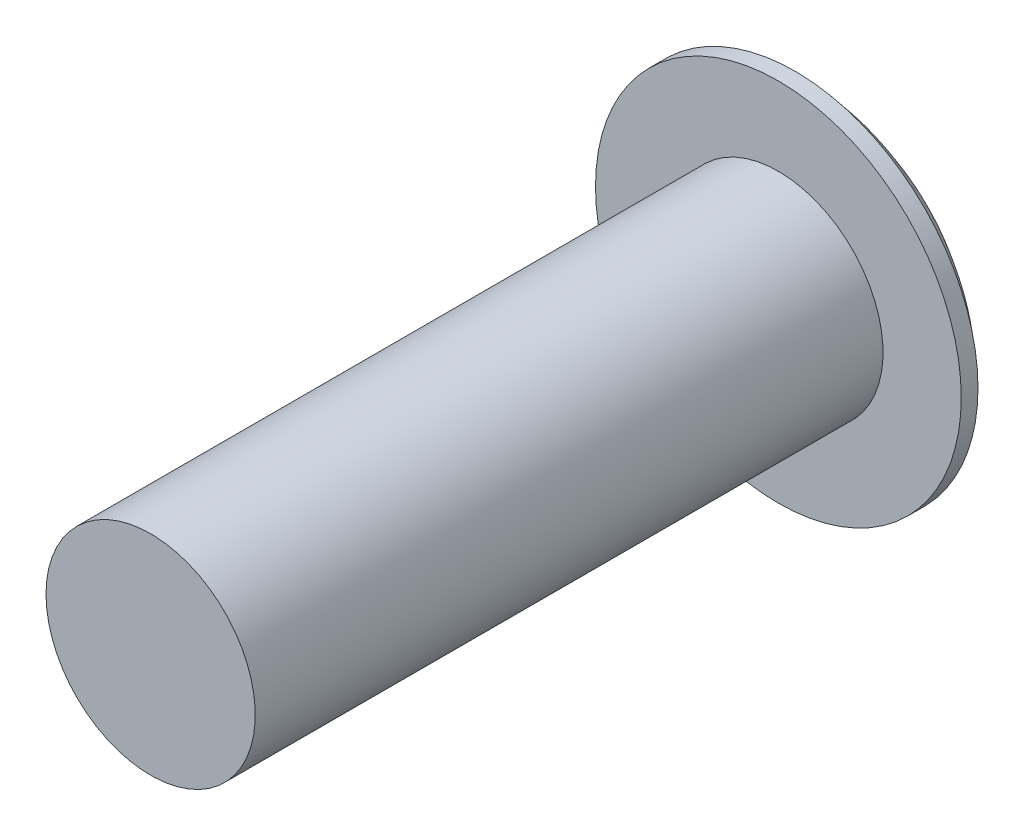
SolidWorks part; units mm, degrees
ref_plane "Front Plane" through (0, 0, 0) normal (0, 0, 1) x (1, 0, 0)
ref_plane "Top Plane" through (0, 0, 0) normal (0, 1, 0) x (1, 0, 0)
ref_plane "Right Plane" through (0, 0, 0) normal (1, 0, 0) x (0, 0, -1)
sketch "Sketch1" plane through (0, 0, 0) normal (1, 0, 0) x (0, 0, -1)
  line L0 (0, 0) -> (3.3528, 0)
  line L1 (0, 5.5499) -> (0.508, 5.5499)
  line L2 (0, 0) -> (0, 5.5499)
  line L3 (0, 0) -> (15.0876, 0) construction
  arc A0 (0.508, 5.5499) -> (3.3528, 0) centre (-9.0254, -2.8408) cw
  dimension "HeadRadius" = 12.7
  dimension "Head Height" = 3.3528
  dimension "Head dia/2" = 5.5499
  dimension "1/4ofHeight" = 0.508
revolve "Revolve1" add sketch "Sketch1" angle 360 about L3
sketch "Sketch2" plane through (0, 0, 0) normal (0, 0, 1) x (1, 0, 0)
  circle A0 centre (0, 0) radius 3.175
extrude "Extrude1" add sketch "Sketch2" along normal blind 19.05
sketch "Sketch3" plane through (0, 0, 0) normal (0, 0, 1) x (1, 0, 0)
  line L1 (-1.0839, 2.0188) -> (-2.2903, 0.0707)
  line L2 (-2.2903, 0.0707) -> (-1.2063, -1.9481)
  line L3 (-1.2063, -1.9481) -> (1.0839, -2.0188)
  line L4 (1.0839, -2.0188) -> (2.2903, -0.0707)
  line L5 (2.2903, -0.0707) -> (1.2063, 1.9481)
  line L6 (1.2063, 1.9481) -> (-1.0839, 2.0188)
  circle A0 centre (0, 0) radius 1.9844 construction
extrude "Extrude2" cut sketch "Sketch3" against normal blind 6.35
